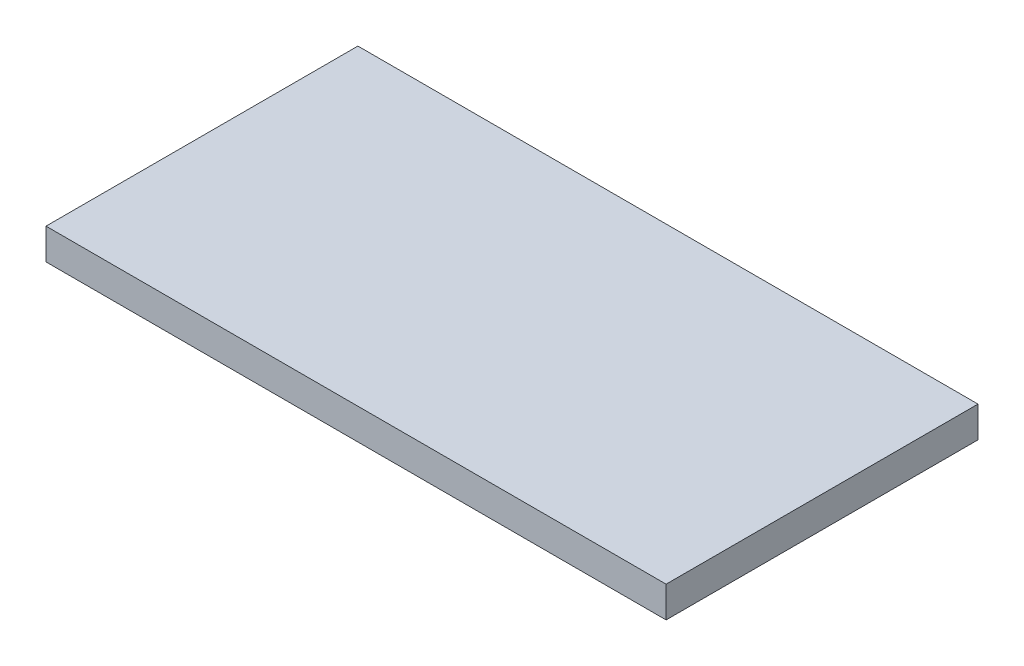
SolidWorks part; units mm, degrees
ref_plane "Front" through (0, 0, 0) normal (0, 0, 1) x (1, 0, 0)
ref_plane "Top" through (0, 0, 0) normal (0, 1, 0) x (1, 0, 0)
ref_plane "Right" through (0, 0, 0) normal (1, 0, 0) x (0, 0, -1)
sketch "Sketch1" plane through (0, 0, 0) normal (0, 1, 0) x (1, 0, 0)
  line L0 (0, 0) -> (161.7169, 0)
sketch "Sketch2" plane through (0, 0, 0) normal (1, 0, 0) x (0, 0, -1)
  line L0 (0, 0) -> (0, 17.0821) construction
  line L1 (11.8641, 0) -> (-11.8641, 0)
  line L3 (11.8641, 0) -> (11.8641, 7.6837)
  line L4 (-6.5094, 7.6837) -> (-6.5094, 16.0574)
  line L5 (11.8641, 7.6837) -> (6.5094, 7.6837)
  line L6 (-11.8641, 7.6837) -> (-6.5094, 7.6837)
  line L7 (6.5094, 7.6837) -> (6.5094, 16.0574)
  line L8 (-6.5094, 16.0574) -> (6.5094, 16.0574)
  line L9 (-11.8641, 0) -> (-11.8641, 7.6837)
  point P7 (0, 16.0574)
sketch "Sketch3" plane through (0, 0, 0) normal (0, 1, 0) x (1, 0, 0)
  line L1 (-20.2288, 43.8637) -> (179.8294, 43.8637)
  line L2 (-20.2288, 43.8637) -> (-20.2288, -56.7622)
  line L3 (-20.2288, -56.7622) -> (179.8294, -56.7622)
  line L4 (179.8294, 43.8637) -> (179.8294, -56.7622)
extrude "Extrude1" add sketch "Sketch3" against normal blind 10
